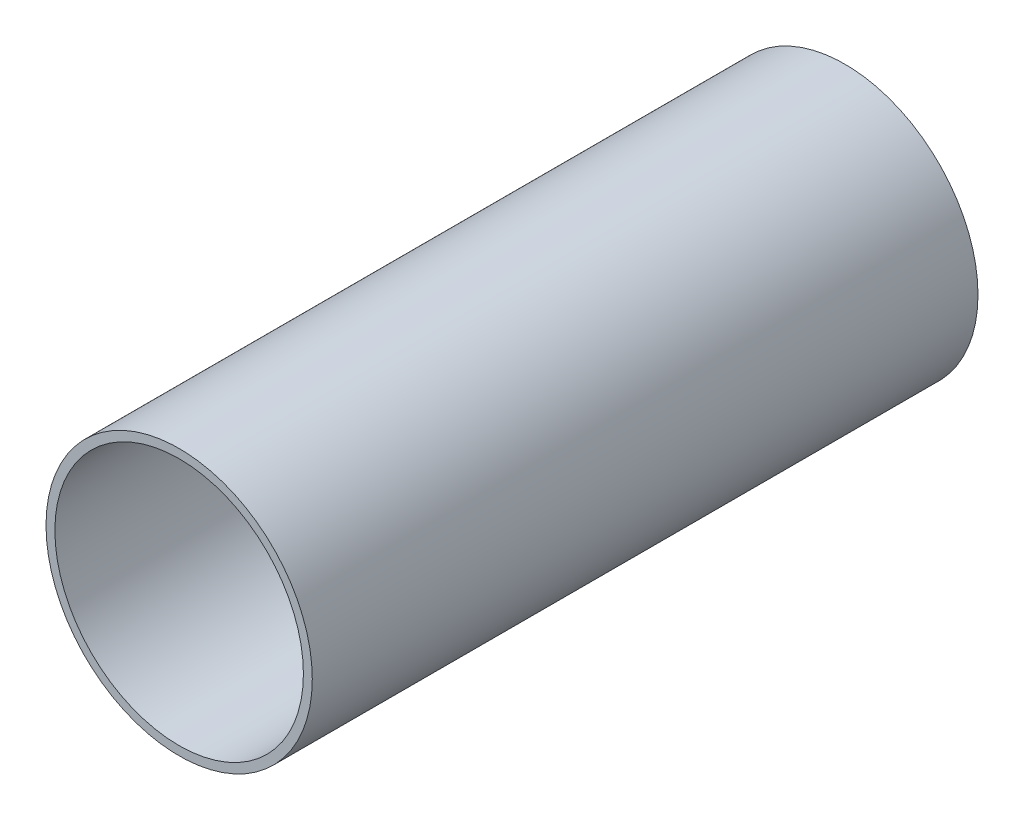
SolidWorks part; units mm, degrees
ref_plane "Plan de face" through (0, 0, 0) normal (0, 0, 1) x (1, 0, 0)
ref_plane "Plan de dessus" through (0, 0, 0) normal (0, 1, 0) x (1, 0, 0)
ref_plane "Plan de droite" through (0, 0, 0) normal (1, 0, 0) x (0, 0, -1)
sketch "Esquisse1" plane through (0, 0, 0) normal (0, 0, 1) x (1, 0, 0)
  circle A0 centre (0, 0) radius 5.6
  circle A1 centre (0, 0) radius 6
  dimension "D1" = 11.2
  dimension "D2" = 12
extrude "Boss.-Extru.1" add sketch "Esquisse1" along normal blind 30
ref_plane "Plan1" through (-6, 0, 0) normal (-1, 0, 0) x (0, 0, -1)
sketch "Esquisse2" plane through (-6, 0, 0) normal (-1, 0, 0) x (0, 0, -1)
  line L0 (0, 0) -> (-27.375, 0) construction
  line L1 (0, -6) -> (0, 6) construction
  line L2 (-30, 6) -> (-30, -6) construction
  line L3 (-28.125, 2) -> (-28.125, 0) construction
  line L4 (-23, 2) -> (-23.25, 2)
  line L6 (-28, 0.05) -> (-28, 2)
  line L7 (-28, 2) -> (-28.25, 2)
  line L8 (-28.25, 0) -> (-28.25, 2)
  line L9 (-28.125, 0) -> (-28.25, 2) construction
  line L10 (-28, 2) -> (-28.125, 0) construction
  line L11 (-23.25, 0.05) -> (-23.25, 2)
  line L12 (-23, 0.05) -> (-23, 2)
  line L14 (-18, 2) -> (-18.25, 2)
  line L15 (-18.25, 0.05) -> (-18.25, 2)
  line L16 (-18, 0.05) -> (-18, 2)
  line L18 (-13, 2) -> (-13.25, 2)
  line L19 (-13.25, 0.05) -> (-13.25, 2)
  line L20 (-13, 0.05) -> (-13, 2)
  line L22 (-8, 2) -> (-8.25, 2)
  line L23 (-8.25, 0.05) -> (-8.25, 2)
  line L24 (-8, 0.05) -> (-8, 2)
  line L26 (-3, 2) -> (-3.25, 2)
  line L27 (-3.25, 0.05) -> (-3.25, 2)
  line L28 (-3, 0) -> (-3, 2)
  line L29 (-29.625, 2.25) -> (-26.625, 2.25) construction
  line L111 (-28, 2) -> (-23, 2) construction
  line L112 (-28.125, 2.25) -> (-28.125, 2) construction
  line L113 (-24.625, 2.25) -> (-21.625, 2.25) construction
  line L114 (-19.625, 2.25) -> (-16.625, 2.25) construction
  line L115 (-14.625, 2.25) -> (-11.625, 2.25) construction
  line L116 (-9.625, 2.25) -> (-6.625, 2.25) construction
  line L117 (-4.625, 2.25) -> (-1.625, 2.25) construction
  line L126 (-27.575, -0.05) -> (-27.575, -1)
  line L127 (-27.575, -1) -> (-27.475, -1)
  line L128 (-27.475, -0.05) -> (-27.475, -1)
  line L160 (-26.625, -0.05) -> (-26.625, -1)
  line L162 (-27.1, 0.05) -> (-27.1, 1)
  line L163 (-27.1, 1) -> (-27, 1)
  line L164 (-27, 0.05) -> (-27, 1)
  line L166 (-26.525, -0.05) -> (-26.525, -1)
  line L167 (-26.625, -1) -> (-26.525, -1)
  line L168 (-25.675, -0.05) -> (-25.675, -1)
  line L170 (-25.575, -0.05) -> (-25.575, -1)
  line L171 (-25.675, -1) -> (-25.575, -1)
  line L172 (-24.725, -0.05) -> (-24.725, -1)
  line L174 (-24.625, -0.05) -> (-24.625, -1)
  line L175 (-24.725, -1) -> (-24.625, -1)
  line L176 (-23.775, -0.05) -> (-23.775, -1)
  line L178 (-23.675, -0.05) -> (-23.675, -1)
  line L179 (-23.775, -1) -> (-23.675, -1)
  line L192 (-26.15, 0.05) -> (-26.15, 1)
  line L194 (-26.05, 0.05) -> (-26.05, 1)
  line L195 (-26.15, 1) -> (-26.05, 1)
  line L196 (-25.2, 0.05) -> (-25.2, 1)
  line L198 (-25.1, 0.05) -> (-25.1, 1)
  line L199 (-25.2, 1) -> (-25.1, 1)
  line L200 (-24.25, 0.05) -> (-24.25, 1)
  line L202 (-24.15, 0.05) -> (-24.15, 1)
  line L203 (-24.25, 1) -> (-24.15, 1)
  line L204 (-26.475, 0) -> (-25.525, 0) construction
  line L205 (-22.575, -0.05) -> (-22.575, -1)
  line L207 (-22.475, -0.05) -> (-22.475, -1)
  line L208 (-22.575, -1) -> (-22.475, -1)
  line L209 (-22.1, 0.05) -> (-22.1, 1)
  line L211 (-22, 0.05) -> (-22, 1)
  line L212 (-22.1, 1) -> (-22, 1)
  line L213 (-21.625, -0.05) -> (-21.625, -1)
  line L214 (-21.625, -1) -> (-21.525, -1)
  line L215 (-21.525, -0.05) -> (-21.525, -1)
  line L217 (-21.15, 0.05) -> (-21.15, 1)
  line L218 (-21.15, 1) -> (-21.05, 1)
  line L219 (-21.05, 0.05) -> (-21.05, 1)
  line L221 (-20.675, -0.05) -> (-20.675, -1)
  line L222 (-20.675, -1) -> (-20.575, -1)
  line L223 (-20.575, -0.05) -> (-20.575, -1)
  line L225 (-20.2, 0.05) -> (-20.2, 1)
  line L226 (-20.2, 1) -> (-20.1, 1)
  line L227 (-20.1, 0.05) -> (-20.1, 1)
  line L229 (-19.725, -0.05) -> (-19.725, -1)
  line L230 (-19.725, -1) -> (-19.625, -1)
  line L231 (-19.625, -0.05) -> (-19.625, -1)
  line L233 (-19.25, 0.05) -> (-19.25, 1)
  line L234 (-19.25, 1) -> (-19.15, 1)
  line L235 (-19.15, 0.05) -> (-19.15, 1)
  line L237 (-18.775, -0.05) -> (-18.775, -1)
  line L238 (-18.775, -1) -> (-18.675, -1)
  line L239 (-18.675, -0.05) -> (-18.675, -1)
  line L241 (-17.575, -0.05) -> (-17.575, -1)
  line L243 (-17.475, -0.05) -> (-17.475, -1)
  line L244 (-17.575, -1) -> (-17.475, -1)
  line L245 (-17.1, 0.05) -> (-17.1, 1)
  line L247 (-17, 0.05) -> (-17, 1)
  line L248 (-17.1, 1) -> (-17, 1)
  line L249 (-16.625, -0.05) -> (-16.625, -1)
  line L250 (-16.625, -1) -> (-16.525, -1)
  line L251 (-16.525, -0.05) -> (-16.525, -1)
  line L253 (-16.15, 0.05) -> (-16.15, 1)
  line L254 (-16.15, 1) -> (-16.05, 1)
  line L255 (-16.05, 0.05) -> (-16.05, 1)
  line L257 (-15.675, -0.05) -> (-15.675, -1)
  line L258 (-15.675, -1) -> (-15.575, -1)
  line L259 (-15.575, -0.05) -> (-15.575, -1)
  line L261 (-15.2, 0.05) -> (-15.2, 1)
  line L262 (-15.2, 1) -> (-15.1, 1)
  line L263 (-15.1, 0.05) -> (-15.1, 1)
  line L265 (-14.725, -0.05) -> (-14.725, -1)
  line L266 (-14.725, -1) -> (-14.625, -1)
  line L267 (-14.625, -0.05) -> (-14.625, -1)
  line L269 (-14.25, 0.05) -> (-14.25, 1)
  line L270 (-14.25, 1) -> (-14.15, 1)
  line L271 (-14.15, 0.05) -> (-14.15, 1)
  line L273 (-13.775, -0.05) -> (-13.775, -1)
  line L274 (-13.775, -1) -> (-13.675, -1)
  line L275 (-13.675, -0.05) -> (-13.675, -1)
  line L277 (-12.575, -0.05) -> (-12.575, -1)
  line L279 (-12.475, -0.05) -> (-12.475, -1)
  line L280 (-12.575, -1) -> (-12.475, -1)
  line L281 (-12.1, 0.05) -> (-12.1, 1)
  line L283 (-12, 0.05) -> (-12, 1)
  line L284 (-12.1, 1) -> (-12, 1)
  line L285 (-11.625, -0.05) -> (-11.625, -1)
  line L286 (-11.625, -1) -> (-11.525, -1)
  line L287 (-11.525, -0.05) -> (-11.525, -1)
  line L289 (-11.15, 0.05) -> (-11.15, 1)
  line L290 (-11.15, 1) -> (-11.05, 1)
  line L291 (-11.05, 0.05) -> (-11.05, 1)
  line L293 (-10.675, -0.05) -> (-10.675, -1)
  line L294 (-10.675, -1) -> (-10.575, -1)
  line L295 (-10.575, -0.05) -> (-10.575, -1)
  line L297 (-10.2, 0.05) -> (-10.2, 1)
  line L298 (-10.2, 1) -> (-10.1, 1)
  line L299 (-10.1, 0.05) -> (-10.1, 1)
  line L301 (-9.725, -0.05) -> (-9.725, -1)
  line L302 (-9.725, -1) -> (-9.625, -1)
  line L303 (-9.625, -0.05) -> (-9.625, -1)
  line L305 (-9.25, 0.05) -> (-9.25, 1)
  line L306 (-9.25, 1) -> (-9.15, 1)
  line L307 (-9.15, 0.05) -> (-9.15, 1)
  line L309 (-8.775, -0.05) -> (-8.775, -1)
  line L310 (-8.775, -1) -> (-8.675, -1)
  line L311 (-8.675, -0.05) -> (-8.675, -1)
  line L313 (-7.575, -0.05) -> (-7.575, -1)
  line L315 (-7.475, -0.05) -> (-7.475, -1)
  line L316 (-7.575, -1) -> (-7.475, -1)
  line L317 (-7.1, 0.05) -> (-7.1, 1)
  line L319 (-7, 0.05) -> (-7, 1)
  line L320 (-7.1, 1) -> (-7, 1)
  line L321 (-6.625, -0.05) -> (-6.625, -1)
  line L322 (-6.625, -1) -> (-6.525, -1)
  line L323 (-6.525, -0.05) -> (-6.525, -1)
  line L325 (-6.15, 0.05) -> (-6.15, 1)
  line L326 (-6.15, 1) -> (-6.05, 1)
  line L327 (-6.05, 0.05) -> (-6.05, 1)
  line L329 (-5.675, -0.05) -> (-5.675, -1)
  line L330 (-5.675, -1) -> (-5.575, -1)
  line L331 (-5.575, -0.05) -> (-5.575, -1)
  line L333 (-5.2, 0.05) -> (-5.2, 1)
  line L334 (-5.2, 1) -> (-5.1, 1)
  line L335 (-5.1, 0.05) -> (-5.1, 1)
  line L337 (-4.725, -0.05) -> (-4.725, -1)
  line L338 (-4.725, -1) -> (-4.625, -1)
  line L339 (-4.625, -0.05) -> (-4.625, -1)
  line L341 (-4.25, 0.05) -> (-4.25, 1)
  line L342 (-4.25, 1) -> (-4.15, 1)
  line L343 (-4.15, 0.05) -> (-4.15, 1)
  line L345 (-3.775, -0.05) -> (-3.775, -1)
  line L346 (-3.775, -1) -> (-3.675, -1)
  line L347 (-3.675, -0.05) -> (-3.675, -1)
  line L349 (-26.95, 0) -> (-21.95, 0) construction
  line L350 (-28.25, 0) -> (-28.25, -0.05)
  line L351 (-28, 0.05) -> (-27.1, 0.05)
  line L353 (-28, -0.05) -> (-27.575, -0.05)
  line L355 (-3, 0) -> (-3, -0.05)
  line L382 (-28.25, -0.05) -> (-28, -0.05)
  line L383 (-28.25, 0) -> (-30, 0) construction
  line L384 (-27, 0.05) -> (-26.15, 0.05)
  line L385 (-27.475, -0.05) -> (-26.625, -0.05)
  line L386 (-26.525, -0.05) -> (-25.675, -0.05)
  line L387 (-26.05, 0.05) -> (-25.2, 0.05)
  line L388 (-25.575, -0.05) -> (-24.725, -0.05)
  line L389 (-25.1, 0.05) -> (-24.25, 0.05)
  line L390 (-24.625, -0.05) -> (-23.775, -0.05)
  line L391 (-24.15, 0.05) -> (-23.25, 0.05)
  line L392 (-23.675, -0.05) -> (-22.575, -0.05)
  line L393 (-23, 0.05) -> (-22.1, 0.05)
  line L394 (-22.475, -0.05) -> (-21.625, -0.05)
  line L395 (-22, 0.05) -> (-21.15, 0.05)
  line L396 (-21.525, -0.05) -> (-20.675, -0.05)
  line L397 (-21.05, 0.05) -> (-20.2, 0.05)
  line L398 (-20.575, -0.05) -> (-19.725, -0.05)
  line L399 (-20.1, 0.05) -> (-19.25, 0.05)
  line L400 (-19.625, -0.05) -> (-18.775, -0.05)
  line L401 (-19.15, 0.05) -> (-18.25, 0.05)
  line L402 (-18.675, -0.05) -> (-17.575, -0.05)
  line L403 (-18, 0.05) -> (-17.1, 0.05)
  line L404 (-17.475, -0.05) -> (-16.625, -0.05)
  line L405 (-17, 0.05) -> (-16.15, 0.05)
  line L406 (-16.525, -0.05) -> (-15.675, -0.05)
  line L407 (-16.05, 0.05) -> (-15.2, 0.05)
  line L408 (-15.575, -0.05) -> (-14.725, -0.05)
  line L409 (-15.1, 0.05) -> (-14.25, 0.05)
  line L410 (-14.625, -0.05) -> (-13.775, -0.05)
  line L411 (-14.15, 0.05) -> (-13.25, 0.05)
  line L412 (-13.675, -0.05) -> (-12.575, -0.05)
  line L413 (-13, 0.05) -> (-12.1, 0.05)
  line L414 (-12.475, -0.05) -> (-11.625, -0.05)
  line L415 (-12, 0.05) -> (-11.15, 0.05)
  line L416 (-11.525, -0.05) -> (-10.675, -0.05)
  line L417 (-11.05, 0.05) -> (-10.2, 0.05)
  line L418 (-10.575, -0.05) -> (-9.725, -0.05)
  line L419 (-9.15, 0.05) -> (-8.25, 0.05)
  line L420 (-9.625, -0.05) -> (-8.775, -0.05)
  line L421 (-10.1, 0.05) -> (-9.25, 0.05)
  line L422 (-8.675, -0.05) -> (-7.575, -0.05)
  line L423 (-8, 0.05) -> (-7.1, 0.05)
  line L424 (-7.475, -0.05) -> (-6.625, -0.05)
  line L425 (-7, 0.05) -> (-6.15, 0.05)
  line L426 (-6.525, -0.05) -> (-5.675, -0.05)
  line L427 (-6.05, 0.05) -> (-5.2, 0.05)
  line L428 (-5.575, -0.05) -> (-4.725, -0.05)
  line L429 (-5.1, 0.05) -> (-4.25, 0.05)
  line L430 (-4.625, -0.05) -> (-3.775, -0.05)
  line L431 (-4.15, 0.05) -> (-3.25, 0.05)
  line L432 (-3.675, -0.05) -> (-3, -0.05)
  text T0 "0" font "Century Gothic" height 1
  text T1 "5" font "Century Gothic" height 1
  text T2 "10" font "Century Gothic" height 1
  text T3 "15" font "Century Gothic" height 1
  text T4 "20" font "Century Gothic" height 1
  text T5 "25" font "Century Gothic" height 1
  point P7 (0, 0)
  point P9 (-28.125, 0)
  point P59 (-27.05, 1)
wrap "Enroulement1" sketch "Esquisse2" wrap type deboss source sketch "Esquisse2" thickness 0.2 parameters "D1"=0.2
equation "\"D9@Esquisse2\"=\"D8@Esquisse2\""
equation "\"D16@Esquisse2\"=\"D8@Esquisse2\""
equation "\"D18@Esquisse2\"=\"D8@Esquisse2\""
equation "\"D19@Esquisse2\"=\"D8@Esquisse2\""
equation "\"D21@Esquisse2\"=\"D20@Esquisse2\""
